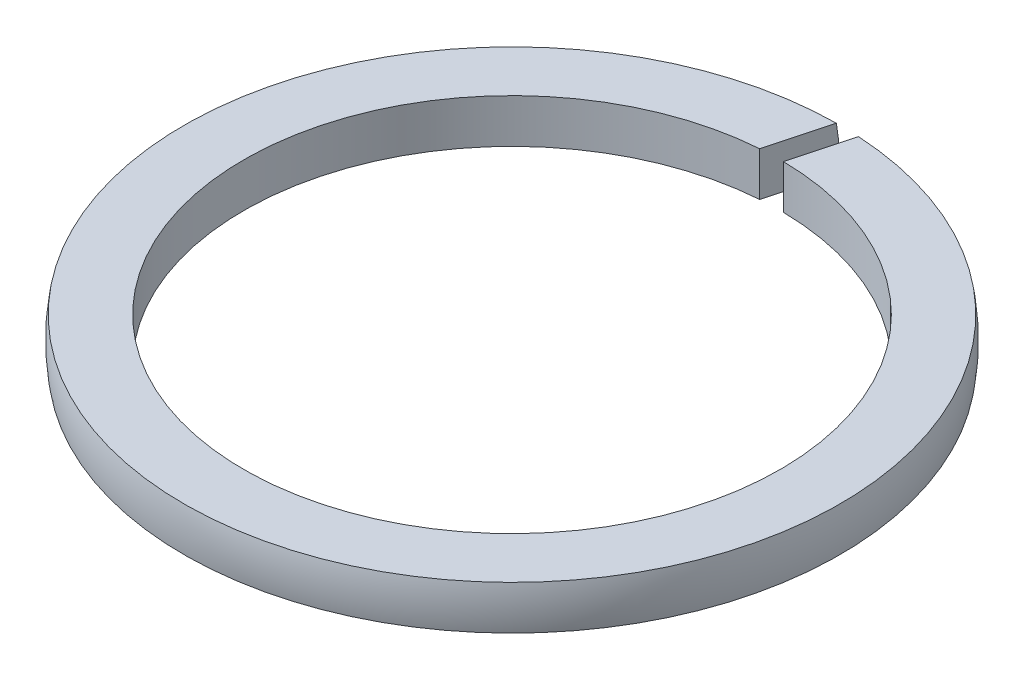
SolidWorks part; units mm, degrees
ref_plane "Plan de face" through (0, 0, 0) normal (0, 0, 1) x (1, 0, 0)
ref_plane "Plan de dessus" through (0, 0, 0) normal (0, 1, 0) x (1, 0, 0)
ref_plane "Plan de droite" through (0, 0, 0) normal (1, 0, 0) x (0, 0, -1)
sketch "Esquisse1" plane through (0, 0, 0) normal (0, 0, 1) x (1, 0, 0)
  line L0 (0, 0) -> (0, 2.4336) construction
  line L2 (-6.1, -0.5) -> (-7.458, -0.5)
  line L3 (-6.1, -0.5) -> (-6.1, 0.5)
  line L4 (-6.1, 0.5) -> (-7.458, 0.5)
  arc A0 (-7.458, 0.5) -> (-7.458, -0.5) centre (-4.5, 0) ccw
  point P6 (-6.1, 0)
  dimension "D1" = 1
  dimension "D3" = 15
  dimension "D4" = 3
  dimension "D2" = 12.2
revolve "Révolution1" add sketch "Esquisse1" angle 360 about L0
sketch "Esquisse2" plane through (0, 0, 0) normal (0, 1, 0) x (1, 0, 0)
  line L0 (-0.0705, 7.4997) -> (-0.45, 6.0834)
  line L1 (0.4485, 7.5045) -> (0.072, 6.0996)
  line L2 (-0.0705, 7.4997) -> (0.4485, 7.5045)
  line L3 (0.189, 7.5021) -> (-0.189, 6.0915) construction
  line L4 (-0.45, 6.0834) -> (0.072, 6.0996)
  line L5 (0, -0.55) -> (0, 0.55) construction
  circle A0 centre (0, 0) radius 7.5 construction
  circle A1 centre (0, 0) radius 6.1 construction
  point P9 (0, 6.7968)
  dimension "D1" = 0.5
  dimension "D2" = 15
extrude "Enlèv. mat.-Extru.1" cut sketch "Esquisse2" against normal through all and the other way through all
